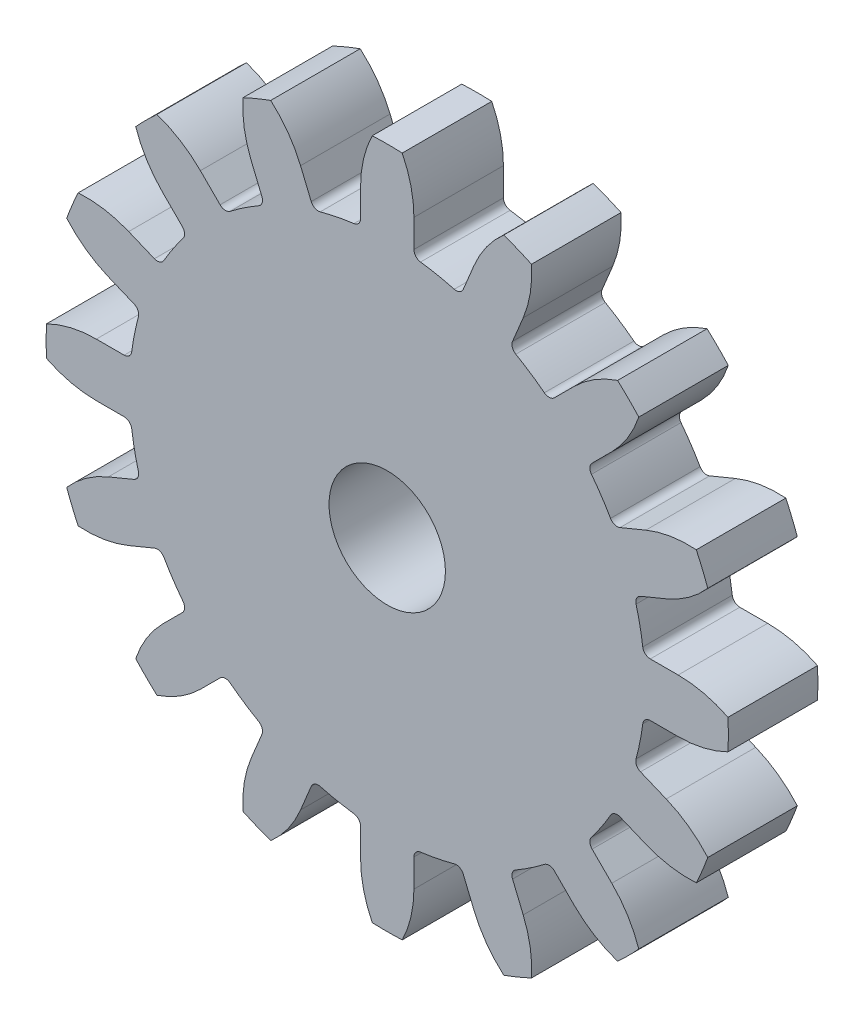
SolidWorks part; units mm, degrees
ref_plane "Спереди" through (0, 0, 0) normal (0, 0, 1) x (1, 0, 0)
ref_plane "Сверху" through (0, 0, 0) normal (0, 1, 0) x (1, 0, 0)
ref_plane "Справа" through (0, 0, 0) normal (1, 0, 0) x (0, 0, -1)
sketch "Эскиз7" plane through (0, 0, 0) normal (0, 0, 1) x (1, 0, 0)
  line L0 (0, 40.7774) -> (0, 0) construction
  line L1 (-2.98, 32.4964) -> (-2.98, 29.3858)
  line L2 (2.98, 32.4964) -> (2.98, 29.3858)
  line L3 (9.6827, 31.1632) -> (8.4923, 28.2894)
  line L4 (15.189, 28.8824) -> (13.9986, 26.0086)
  line L5 (20.8713, 25.0856) -> (18.6717, 22.8861)
  line L6 (25.0856, 20.8713) -> (22.8861, 18.6717)
  line L7 (28.8824, 15.189) -> (26.0086, 13.9986)
  line L8 (31.1632, 9.6827) -> (28.2894, 8.4923)
  line L9 (32.4964, 2.98) -> (29.3858, 2.98)
  line L10 (32.4964, -2.98) -> (29.3858, -2.98)
  line L11 (31.1632, -9.6827) -> (28.2894, -8.4923)
  line L12 (28.8824, -15.189) -> (26.0086, -13.9986)
  line L13 (25.0856, -20.8713) -> (22.8861, -18.6717)
  line L14 (20.8713, -25.0856) -> (18.6717, -22.8861)
  line L15 (15.189, -28.8824) -> (13.9986, -26.0086)
  line L16 (9.6827, -31.1632) -> (8.4923, -28.2894)
  line L17 (2.98, -32.4964) -> (2.98, -29.3858)
  line L18 (-2.98, -32.4964) -> (-2.98, -29.3858)
  line L19 (-9.6827, -31.1632) -> (-8.4923, -28.2894)
  line L20 (-15.189, -28.8824) -> (-13.9986, -26.0086)
  line L21 (-20.8713, -25.0856) -> (-18.6717, -22.8861)
  line L22 (-25.0856, -20.8713) -> (-22.8861, -18.6717)
  line L23 (-28.8824, -15.189) -> (-26.0086, -13.9986)
  line L24 (-31.1632, -9.6827) -> (-28.2894, -8.4923)
  line L25 (-32.4964, -2.98) -> (-29.3858, -2.98)
  line L26 (-32.4964, 2.98) -> (-29.3858, 2.98)
  line L27 (-31.1632, 9.6827) -> (-28.2894, 8.4923)
  line L28 (-28.8824, 15.189) -> (-26.0086, 13.9986)
  line L29 (-25.0856, 20.8713) -> (-22.8861, 18.6717)
  line L30 (-20.8713, 25.0856) -> (-18.6717, 22.8861)
  line L31 (-15.189, 28.8824) -> (-13.9986, 26.0086)
  line L32 (-9.6827, 31.1632) -> (-8.4923, 28.2894)
  circle A0 centre (0, 0) radius 6.5
  arc A1 (1.6731, 38.0632) -> (-1.6731, 38.0632) centre (0, 0) ccw
  arc A2 (-3.7195, 28.5437) -> (-7.4868, 27.7943) centre (0, 0) ccw
  circle A3 centre (0, 0) radius 33.865 construction
  arc A4 (-1.6731, 38.0632) -> (-2.98, 32.4964) centre (9.53, 32.4964) ccw
  arc A5 (1.6731, 38.0632) -> (2.98, 32.4964) centre (-9.53, 32.4964) cw
  arc A6 (16.112, 34.5256) -> (13.0204, 35.8061) centre (0, 0) ccw
  arc A7 (13.0204, 35.8061) -> (9.6827, 31.1632) centre (21.2404, 26.3758) ccw
  arc A8 (16.112, 34.5256) -> (15.189, 28.8824) centre (3.6313, 33.6698) cw
  arc A9 (28.0979, 25.7317) -> (25.7317, 28.0979) centre (0, 0) ccw
  arc A10 (25.7317, 28.0979) -> (20.8713, 25.0856) centre (29.7172, 16.2397) ccw
  arc A11 (28.0979, 25.7317) -> (25.0856, 20.8713) centre (16.2397, 29.7172) cw
  arc A12 (35.8061, 13.0204) -> (34.5256, 16.112) centre (0, 0) ccw
  arc A13 (34.5256, 16.112) -> (28.8824, 15.189) centre (33.6698, 3.6313) ccw
  arc A14 (35.8061, 13.0204) -> (31.1632, 9.6827) centre (26.3758, 21.2404) cw
  arc A15 (38.0632, -1.6731) -> (38.0632, 1.6731) centre (0, 0) ccw
  arc A16 (38.0632, 1.6731) -> (32.4964, 2.98) centre (32.4964, -9.53) ccw
  arc A17 (38.0632, -1.6731) -> (32.4964, -2.98) centre (32.4964, 9.53) cw
  arc A18 (34.5256, -16.112) -> (35.8061, -13.0204) centre (0, 0) ccw
  arc A19 (35.8061, -13.0204) -> (31.1632, -9.6827) centre (26.3758, -21.2404) ccw
  arc A20 (34.5256, -16.112) -> (28.8824, -15.189) centre (33.6698, -3.6313) cw
  arc A21 (25.7317, -28.0979) -> (28.0979, -25.7317) centre (0, 0) ccw
  arc A22 (28.0979, -25.7317) -> (25.0856, -20.8713) centre (16.2397, -29.7172) ccw
  arc A23 (25.7317, -28.0979) -> (20.8713, -25.0856) centre (29.7172, -16.2397) cw
  arc A24 (13.0204, -35.8061) -> (16.112, -34.5256) centre (0, 0) ccw
  arc A25 (16.112, -34.5256) -> (15.189, -28.8824) centre (3.6313, -33.6698) ccw
  arc A26 (13.0204, -35.8061) -> (9.6827, -31.1632) centre (21.2404, -26.3758) cw
  arc A27 (-1.6731, -38.0632) -> (1.6731, -38.0632) centre (0, 0) ccw
  arc A28 (1.6731, -38.0632) -> (2.98, -32.4964) centre (-9.53, -32.4964) ccw
  arc A29 (-1.6731, -38.0632) -> (-2.98, -32.4964) centre (9.53, -32.4964) cw
  arc A30 (-16.112, -34.5256) -> (-13.0204, -35.8061) centre (0, 0) ccw
  arc A31 (-13.0204, -35.8061) -> (-9.6827, -31.1632) centre (-21.2404, -26.3758) ccw
  arc A32 (-16.112, -34.5256) -> (-15.189, -28.8824) centre (-3.6313, -33.6698) cw
  arc A33 (-28.0979, -25.7317) -> (-25.7317, -28.0979) centre (0, 0) ccw
  arc A34 (-25.7317, -28.0979) -> (-20.8713, -25.0856) centre (-29.7172, -16.2397) ccw
  arc A35 (-28.0979, -25.7317) -> (-25.0856, -20.8713) centre (-16.2397, -29.7172) cw
  arc A36 (-35.8061, -13.0204) -> (-34.5256, -16.112) centre (0, 0) ccw
  arc A37 (-34.5256, -16.112) -> (-28.8824, -15.189) centre (-33.6698, -3.6313) ccw
  arc A38 (-35.8061, -13.0204) -> (-31.1632, -9.6827) centre (-26.3758, -21.2404) cw
  arc A39 (-38.0632, 1.6731) -> (-38.0632, -1.6731) centre (0, 0) ccw
  arc A40 (-38.0632, -1.6731) -> (-32.4964, -2.98) centre (-32.4964, 9.53) ccw
  arc A41 (-38.0632, 1.6731) -> (-32.4964, 2.98) centre (-32.4964, -9.53) cw
  arc A42 (-34.5256, 16.112) -> (-35.8061, 13.0204) centre (0, 0) ccw
  arc A43 (-35.8061, 13.0204) -> (-31.1632, 9.6827) centre (-26.3758, 21.2404) ccw
  arc A44 (-34.5256, 16.112) -> (-28.8824, 15.189) centre (-33.6698, 3.6313) cw
  arc A45 (-25.7317, 28.0979) -> (-28.0979, 25.7317) centre (0, 0) ccw
  arc A46 (-28.0979, 25.7317) -> (-25.0856, 20.8713) centre (-16.2397, 29.7172) ccw
  arc A47 (-25.7317, 28.0979) -> (-20.8713, 25.0856) centre (-29.7172, 16.2397) cw
  arc A48 (-13.0204, 35.8061) -> (-16.112, 34.5256) centre (0, 0) ccw
  arc A49 (-16.112, 34.5256) -> (-15.189, 28.8824) centre (-3.6313, 33.6698) ccw
  arc A50 (-13.0204, 35.8061) -> (-9.6827, 31.1632) centre (-21.2404, 26.3758) cw
  arc A51 (7.4868, 27.7943) -> (3.7195, 28.5437) centre (0, 0) ccw
  arc A52 (17.5533, 22.8135) -> (14.3596, 24.9475) centre (0, 0) ccw
  arc A53 (24.9475, 14.3596) -> (22.8135, 17.5533) centre (0, 0) ccw
  arc A54 (-14.3596, 24.9475) -> (-17.5533, 22.8135) centre (0, 0) ccw
  arc A55 (-22.8135, 17.5533) -> (-24.9475, 14.3596) centre (0, 0) ccw
  arc A56 (-27.7943, 7.4868) -> (-28.5437, 3.7195) centre (0, 0) ccw
  arc A57 (-28.5437, -3.7195) -> (-27.7943, -7.4868) centre (0, 0) ccw
  arc A58 (-24.9475, -14.3596) -> (-22.8135, -17.5533) centre (0, 0) ccw
  arc A59 (-17.5533, -22.8135) -> (-14.3596, -24.9475) centre (0, 0) ccw
  arc A60 (-7.4868, -27.7943) -> (-3.7195, -28.5437) centre (0, 0) ccw
  arc A61 (3.7195, -28.5437) -> (7.4868, -27.7943) centre (0, 0) ccw
  arc A62 (14.3596, -24.9475) -> (17.5533, -22.8135) centre (0, 0) ccw
  arc A63 (22.8135, -17.5533) -> (24.9475, -14.3596) centre (0, 0) ccw
  arc A64 (27.7943, -7.4868) -> (28.5437, -3.7195) centre (0, 0) ccw
  arc A65 (28.5437, 3.7195) -> (27.7943, 7.4868) centre (0, 0) ccw
  arc A66 (22.8861, -18.6717) -> (22.8135, -17.5533) centre (23.4866, -18.0712) cw
  arc A67 (26.0086, -13.9986) -> (24.9475, -14.3596) centre (25.6836, -14.7833) ccw
  arc A68 (28.2894, -8.4923) -> (27.7943, -7.4868) centre (28.6144, -7.7077) cw
  arc A69 (29.3858, -2.98) -> (28.5437, -3.7195) centre (29.3858, -3.8293) ccw
  arc A70 (29.3858, 2.98) -> (28.5437, 3.7195) centre (29.3858, 3.8293) cw
  arc A71 (28.2894, 8.4923) -> (27.7943, 7.4868) centre (28.6144, 7.7077) ccw
  arc A72 (26.0086, 13.9986) -> (24.9475, 14.3596) centre (25.6836, 14.7833) cw
  arc A73 (22.8861, 18.6717) -> (22.8135, 17.5533) centre (23.4866, 18.0712) ccw
  arc A74 (18.6717, 22.8861) -> (17.5533, 22.8135) centre (18.0712, 23.4866) cw
  arc A75 (13.9986, 26.0086) -> (14.3596, 24.9475) centre (14.7833, 25.6836) ccw
  arc A76 (18.6717, -22.8861) -> (17.5533, -22.8135) centre (18.0712, -23.4866) ccw
  arc A77 (13.9986, -26.0086) -> (14.3596, -24.9475) centre (14.7833, -25.6836) cw
  arc A78 (8.4923, -28.2894) -> (7.4868, -27.7943) centre (7.7077, -28.6144) ccw
  arc A79 (2.98, -29.3858) -> (3.7195, -28.5437) centre (3.8293, -29.3858) cw
  arc A80 (-2.98, -29.3858) -> (-3.7195, -28.5437) centre (-3.8293, -29.3858) ccw
  arc A81 (-8.4923, -28.2894) -> (-7.4868, -27.7943) centre (-7.7077, -28.6144) cw
  arc A82 (-13.9986, -26.0086) -> (-14.3596, -24.9475) centre (-14.7833, -25.6836) ccw
  arc A83 (-18.6717, -22.8861) -> (-17.5533, -22.8135) centre (-18.0712, -23.4866) cw
  arc A84 (-22.8861, -18.6717) -> (-22.8135, -17.5533) centre (-23.4866, -18.0712) ccw
  arc A85 (-26.0086, -13.9986) -> (-24.9475, -14.3596) centre (-25.6836, -14.7833) cw
  arc A86 (-28.2894, -8.4923) -> (-27.7943, -7.4868) centre (-28.6144, -7.7077) ccw
  arc A87 (-29.3858, -2.98) -> (-28.5437, -3.7195) centre (-29.3858, -3.8293) cw
  arc A88 (-29.3858, 2.98) -> (-28.5437, 3.7195) centre (-29.3858, 3.8293) ccw
  arc A89 (-28.2894, 8.4923) -> (-27.7943, 7.4868) centre (-28.6144, 7.7077) cw
  arc A90 (-26.0086, 13.9986) -> (-24.9475, 14.3596) centre (-25.6836, 14.7833) ccw
  arc A91 (-22.8861, 18.6717) -> (-22.8135, 17.5533) centre (-23.4866, 18.0712) cw
  arc A92 (-18.6717, 22.8861) -> (-17.5533, 22.8135) centre (-18.0712, 23.4866) ccw
  arc A93 (-13.9986, 26.0086) -> (-14.3596, 24.9475) centre (-14.7833, 25.6836) cw
  arc A94 (8.4923, 28.2894) -> (7.4868, 27.7943) centre (7.7077, 28.6144) cw
  arc A95 (2.98, 29.3858) -> (3.7195, 28.5437) centre (3.8293, 29.3858) ccw
  arc A96 (-2.98, 29.3858) -> (-3.7195, 28.5437) centre (-3.8293, 29.3858) cw
  arc A97 (-8.4923, 28.2894) -> (-7.4868, 27.7943) centre (-7.7077, 28.6144) ccw
  point P208 (2.98, 28.6303)
  point P211 (-2.98, 28.6303)
  dimension "D1" = 13
  dimension "D2" = 76.2
  dimension "D3" = 57.57
  dimension "D4" = 67.73
  dimension "D6" = 25.02
  dimension "D7" = 0.8493
  dimension "D5" = 2.98
  dimension "D8" = 16
extrude "Бобышка-Вытянуть2" add sketch "Эскиз7" along normal blind 10
